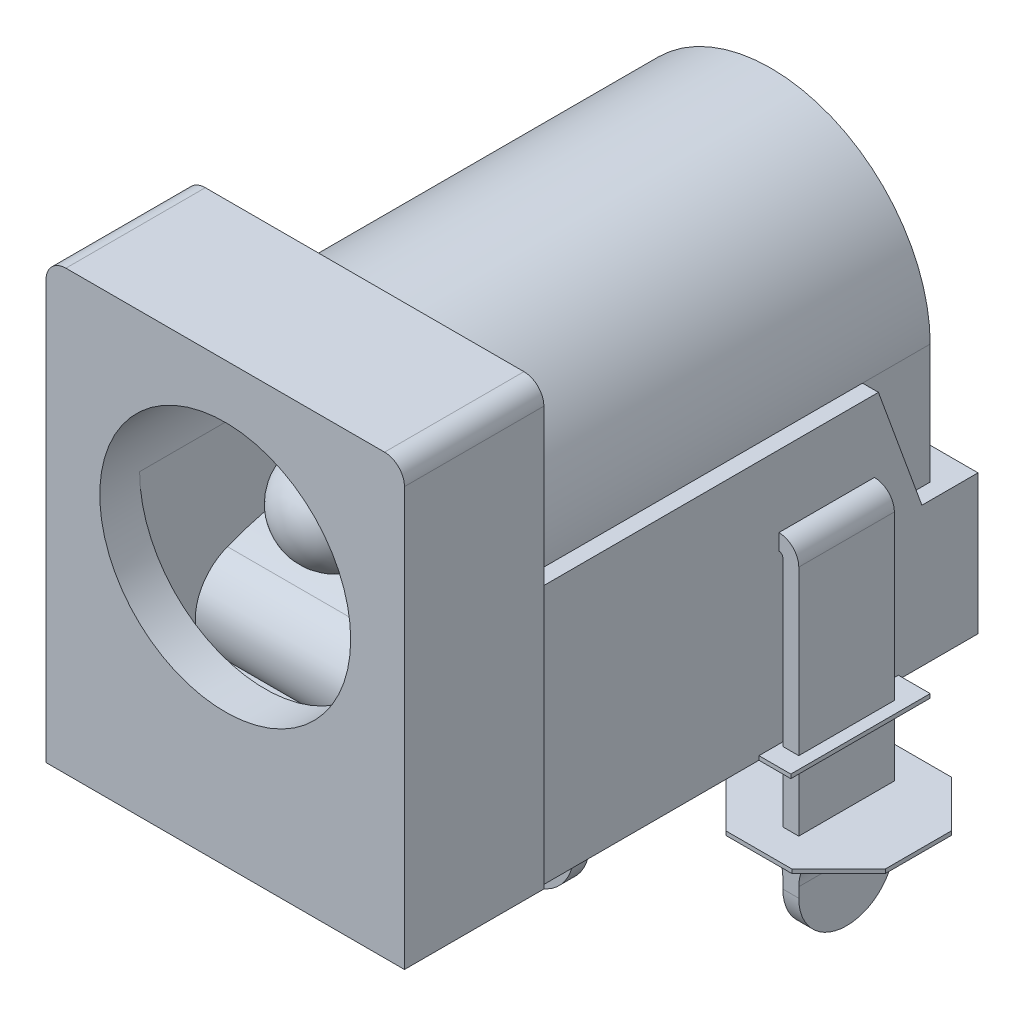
SolidWorks part; units mm, degrees
ref_plane "Front Plane" through (0, 0, 0) normal (0, 0, 1) x (1, 0, 0)
ref_plane "Top Plane" through (0, 0, 0) normal (0, 1, 0) x (1, 0, 0)
ref_plane "Right Plane" through (0, 0, 0) normal (1, 0, 0) x (0, 0, -1)
sketch "Sketch1" plane through (0, 0, 0) normal (0, 0, 1) x (1, 0, 0)
  line L0 (55, 0) -> (-55, 0) construction
  line L1 (-4, 11) -> (4, 11)
  line L2 (-4.5, 10.5) -> (-4.5, 0)
  line L3 (-4.5, 0) -> (4.5, 0)
  line L4 (4.5, 10.5) -> (4.5, 0)
  arc A2 (-4, 11) -> (-4.5, 10.5) centre (-4, 10.5) ccw
  arc A3 (4, 11) -> (4.5, 10.5) centre (4, 10.5) cw
  point P11 (4.5, 0)
  point P14 (-4.5, 11)
  point P17 (4.5, 11)
  dimension "D3" = 0.5
  dimension "D1" = 11
  dimension "D2" = 9
extrude "Boss-Extrude1" add sketch "Sketch1" against normal blind 3.5
sketch "Sketch3" plane through (0, 0, 0) normal (1, 0, 0) x (0, 0, -1)
  line L0 (0, 6.5) -> (12, 6.5)
  line L1 (0, 4.95) -> (0, -4.95) construction
  line L2 (12, 6.5) -> (13.0919, 3.5)
  line L3 (13.0919, 3.5) -> (14.5, 3.5)
  line L4 (14.5, 3.5) -> (14.5, 0)
  line L5 (14.5, 0) -> (0, 0)
  line L6 (0, 0) -> (0, 6.5)
  dimension "D1" = 14.5
  dimension "D2" = 6.5
  dimension "D3" = 3.5
  dimension "D4" = 12
  dimension "D5" = 70
extrude "Boss-Extrude2" add sketch "Sketch3" along normal mid plane 8.8
ref_plane "Plane1" through (0, 0, -13.7) normal (0, 0, 1) x (1, 0, 0)
sketch "Sketch4" plane through (0, 0, -13.7) normal (0, 0, 1) x (1, 0, 0)
  line L0 (0, -6.05) -> (0, 6.05) construction
  line L1 (-4, 6.5) -> (-4, 0)
  line L2 (4.95, 0) -> (-4.95, 0) construction
  line L3 (-4, 0) -> (4, 0)
  line L4 (4, 0) -> (4, 6.5)
  arc A0 (4, 6.5) -> (-4, 6.5) centre (0, 6.5) ccw
  dimension "D1" = 8
  dimension "D2" = 6.5
extrude "Boss-Extrude3" add sketch "Sketch4" along normal blind 12
sketch "Sketch5" plane through (0, 0, 0) normal (0, 0, 1) x (1, 0, 0)
  line L0 (0, -6.05) -> (0, 6.05) construction
  circle A0 centre (0, 6.5) radius 3.15
  arc A1 (4, 6.5) -> (-4, 6.5) centre (0, 6.5) ccw construction
  dimension "D1" = 6.3
extrude "Cut-Extrude1" cut sketch "Sketch5" against normal blind 10
sketch "Sketch6" plane through (0, 0, 0) normal (0, 1, 0) x (1, 0, 0)
  line L0 (4.4, 14.5) -> (-4.4, 14.5) construction
  line L1 (-1.6, 14.5) -> (1.6, 14.5)
  line L2 (-1.6, 14.5) -> (-1.6, 13.7)
  line L3 (-1.6, 13.7) -> (1.6, 13.7)
  line L4 (1.6, 14.5) -> (1.6, 13.7)
  line L5 (-4.95, 13.7) -> (4.95, 13.7) construction
  line L6 (0, -6.05) -> (0, 6.05) construction
  dimension "D1" = 3.2
  dimension "D2" = 1.6
extrude "Cut-Extrude3" cut sketch "Sketch6" along normal blind 10
sketch "Sketch7" plane through (0, 0, -13.7) normal (0, 0, -1) x (-1, 0, 0)
  line L0 (0, 6.05) -> (0, -6.05) construction
  line L3 (-1.5, 5.1771) -> (-1.5, -2.6)
  line L4 (4.95, 0) -> (-4.95, 0) construction
  line L5 (1.5, 5.1771) -> (1.5, -2.6)
  arc A0 (1.5, 5.1771) -> (-1.5, 5.1771) centre (0, 6.5) ccw
  arc A1 (4, 6.5) -> (-4, 6.5) centre (0, 6.5) ccw construction
  arc A2 (-1.5, -2.6) -> (1.5, -2.6) centre (0, -2.6) ccw
  circle A3 centre (0, 6.5) radius 1.25
  dimension "D1" = 4
  dimension "D5" = 2.5
  dimension "D2" = 1.5
  dimension "D3" = 3
  dimension "D4" = 2.6
extrude "Boss-Extrude4" add sketch "Sketch7" along normal blind 0.4 separate body
sketch "Sketch17" plane through (0, 0, -13.7) normal (0, 0, -1) x (-1, 0, 0)
  circle A0 centre (0, 6.5) radius 1.25
  circle A1 centre (0, 6.5) radius 1.25 construction
extrude "Cut-Extrude6" cut sketch "Sketch17" against normal through all
ref_plane "Plane2" through (0, 0, -1) normal (0, 0, 1) x (1, 0, 0)
sketch "Sketch8" plane through (0, 0, -1) normal (0, 0, 1) x (1, 0, 0)
  line L0 (-3.15, 6.5) -> (-3.15, 1.5)
  line L1 (-3.15, 1.5) -> (3.15, 1.5)
  line L2 (3.15, 1.5) -> (3.15, 6.5)
  line L3 (4.95, 0) -> (-4.95, 0) construction
  arc A0 (3.15, 6.5) -> (-3.15, 6.5) centre (0, 6.5) ccw
  circle A1 centre (0, 6.5) radius 3.15 construction
  dimension "D1" = 1.5
extrude "Cut-Extrude4" cut sketch "Sketch8" against normal blind 9
ref_plane "Plane3" through (0, 0, -10.7) normal (0, 0, 1) x (1, 0, 0)
sketch "Sketch9" plane through (0, 0, -10.7) normal (0, 0, 1) x (1, 0, 0)
  line L0 (-3.6, 4.3) -> (4.4, 4.3)
  line L1 (4.5, 0) -> (4.5, 10.5) construction
  line L3 (4.5, 4.2) -> (4.5, -4.2)
  line L4 (4.95, 0) -> (-4.95, 0) construction
  line L5 (0, -7.975) -> (0, 7.975) construction
  arc A0 (4.4, 4.3) -> (4.5, 4.2) centre (4.4, 4.2) cw
  circle A1 centre (0, 6.5) radius 2.75 construction
  circle A2 centre (0, 6.5) radius 3.15 construction
  point P6 (4.5, 4.3)
  dimension "D1" = 0.1
  dimension "D5" = 5.5
  dimension "D2" = 4.2
  dimension "D3" = 4.3
  dimension "D4" = 8
extrude "Extrude-Thin1" add sketch "Sketch9" along normal mid plane 2.4 thin
fillet "Fillet1" radius 1.2 2 edges at (4.7, -4.2, -11.9) (4.7, -4.2, -9.5)
sketch "Sketch11" plane through (0, 0, 0) normal (-1, 0, 0) x (0, 0, 1)
  line L0 (-7.5, -4.1) -> (-7.5, 1.4)
  line L1 (-10, 1.5) -> (-1, 1.5) construction
  line L2 (-7.4, 1.5) -> (-3.5, 1.5)
  line L3 (-8.5, 4.2) -> (-10, 4.2)
  line L4 (-10, 4.3) -> (-10, 1.5) construction
  line L5 (-6.2135, 4.5) -> (-6.2135, 0) construction
  line L6 (-1, -5.17) -> (-1, 5.17) construction
  line L7 (0, -4.95) -> (0, 4.95) construction
  line L10 (4.95, 0) -> (-4.95, 0) construction
  arc A0 (-3.5, 1.5) -> (-3.0545, 3.9179) centre (-3.5, 2.75) ccw
  arc A1 (-3.0545, 3.9179) -> (-8.5, 4.2) centre (-6.2135, -4.3632) ccw
  arc A2 (-7.5, 1.4) -> (-7.4, 1.5) centre (-7.4, 1.4) cw
  point P14 (-5.5, 1.5)
  dimension "D1" = 0.1
  dimension "D4" = 2.5
  dimension "D8" = 1.25
  dimension "D2" = 7.5
  dimension "D3" = 4.5
  dimension "D5" = 4.2
  dimension "D6" = 1.5
  dimension "D7" = 4.1
extrude "Extrude-Thin2" add sketch "Sketch11" along normal mid plane 6 separate body thin
sketch "Sketch12" plane through (0, 0, -7.5) normal (0, 0, 1) x (1, 0, 0)
  line L0 (-1.25, 0) -> (-1.25, -2.85)
  line L1 (4.95, 0) -> (-4.95, 0) construction
  line L2 (1.25, -2.85) -> (1.25, 0)
  line L3 (1.25, 0) -> (3.3, 0)
  line L4 (3.3, 0) -> (3.3, -5)
  line L5 (3.3, -5) -> (-3.3, -5)
  line L6 (-3.3, -5) -> (-3.3, 0)
  line L7 (0, -7.975) -> (0, 7.975) construction
  line L8 (-3.3, 0) -> (-1.25, 0)
  arc A0 (-1.25, -2.85) -> (1.25, -2.85) centre (0, -2.85) ccw
  dimension "D3" = 1.25
  dimension "D1" = 6.6
  dimension "D2" = 3.3
  dimension "D4" = 2.85
  dimension "D5" = 5
extrude "Cut-Extrude5" cut sketch "Sketch12" against normal blind 2
sketch "Sketch16" plane through (0, 0, 0) normal (1, 0, 0) x (0, 0, -1)
  line L1 (2.75, 7.75) -> (14.1, 7.75)
  line L2 (14.1, 5.25) -> (14.1, 7.75) construction
  line L3 (14.1, 7.75) -> (14.1, 8.3)
  line L4 (14.1, 5.1771) -> (14.1, 8.5) construction
  line L5 (14.1, 8.3) -> (14.6, 8.3)
  line L6 (14.6, 8.3) -> (14.6, 7.5)
  line L7 (1.5, 6.5) -> (13.6, 6.5)
  line L8 (0, 5.17) -> (0, -5.17) construction
  line L9 (-2.6287, 6.5) -> (17.8038, 6.5) construction
  line L10 (5.17, 0) -> (-5.17, 0) construction
  arc A0 (2.75, 7.75) -> (1.5, 6.5) centre (2.75, 6.5) ccw
  arc A1 (14.6, 7.5) -> (13.6, 6.5) centre (14.6, 6.5) ccw
  dimension "D1" = 2.5
  dimension "D3" = 1
  dimension "D2" = 6.5
  dimension "D4" = 0.5
  dimension "D5" = 1.5
  dimension "D6" = 3.6
revolve "Revolve1" add sketch "Sketch16" angle 360 about L9
ref_plane "Plane4" through (0, -1.65, 0) normal (0, 1, 0) x (1, 0, 0)
sketch "Sketch19" plane through (0, 0, 0) normal (0, 1, 0) x (1, 0, 0)
  line L0 (4.4, 12) -> (4.4, 3.5) construction
  line L1 (5.2, 12.5) -> (4.4, 12.5)
  line L2 (5.2, 12.5) -> (5.2, 9)
  line L3 (5.2, 9) -> (4.4, 9)
  line L4 (4.4, 12.5) -> (4.4, 9)
  line L5 (-5.17, 0) -> (5.17, 0) construction
  line L6 (0, -8.03) -> (0, 8.03) construction
  line L7 (-1.6, 14.7) -> (1.6, 14.7)
  line L8 (-1.6, 14.7) -> (-1.6, 13.7)
  line L9 (-1.6, 13.7) -> (1.6, 13.7)
  line L10 (1.6, 14.7) -> (1.6, 13.7)
  line L11 (-1.6, 13.7) -> (1.6, 13.7) construction
  dimension "D1" = 3.5
  dimension "D2" = 9
  dimension "D3" = 0.8
  dimension "D4" = 1
  dimension "D5" = 3.2
  dimension "D6" = 1.6
extrude "Boss-Extrude5" add sketch "Sketch19" along normal blind 0.1
sketch "Sketch20" plane through (0, -1.65, 0) normal (0, 1, 0) x (1, 0, 0)
  line L0 (0, -8.085) -> (0, 8.085) construction
  line L1 (-0.8284, 9.7) -> (-2, 8.5284)
  line L2 (-2, 8.5284) -> (-2, 6.8716)
  line L3 (-2, 6.8716) -> (-0.8284, 5.7)
  line L4 (-0.8284, 5.7) -> (0.8284, 5.7)
  line L5 (0.8284, 5.7) -> (2, 6.8716)
  line L6 (2, 6.8716) -> (2, 8.5284)
  line L7 (2, 8.5284) -> (0.8284, 9.7)
  line L8 (0.8284, 9.7) -> (-0.8284, 9.7)
  line L9 (4.9, 10.7) -> (4.5, 10.7) construction
  line L10 (3.8716, 12.7) -> (2.7, 11.5284)
  line L11 (2.7, 11.5284) -> (2.7, 9.8716)
  line L12 (2.7, 9.8716) -> (3.8716, 8.7)
  line L13 (3.8716, 8.7) -> (5.5284, 8.7)
  line L14 (5.5284, 8.7) -> (6.7, 9.8716)
  line L15 (6.7, 9.8716) -> (6.7, 11.5284)
  line L16 (6.7, 11.5284) -> (5.5284, 12.7)
  line L17 (5.5284, 12.7) -> (3.8716, 12.7)
  line L18 (1.25, 7.9) -> (-1.25, 7.9) construction
  line L19 (2, 14.7284) -> (0.8284, 15.9)
  line L20 (0.8284, 15.9) -> (-0.8284, 15.9)
  line L21 (-0.8284, 15.9) -> (-2, 14.7284)
  line L22 (-2, 14.7284) -> (-2, 13.0716)
  line L23 (-2, 13.0716) -> (-0.8284, 11.9)
  line L24 (-0.8284, 11.9) -> (0.8284, 11.9)
  line L25 (0.8284, 11.9) -> (2, 13.0716)
  line L26 (2, 13.0716) -> (2, 14.7284)
  line L27 (-1.5, 13.7) -> (1.5, 13.7) construction
  circle A0 centre (0, 7.7) radius 2 construction
  circle A1 centre (4.7, 10.7) radius 2 construction
  circle A2 centre (0, 13.9) radius 2 construction
  dimension "D1" = 4
  dimension "D2" = 0.2
  dimension "D3" = 0.2
extrude "Boss-Extrude6" add sketch "Sketch20" against normal blind 0.1
fillet "Fillet4" radius 1 6 edges at (0, -1.75, -14.1) (4.5, -1.75, -10.7) (4.9, -1.75, -10.7) (0, -1.75, -7.5) (0, -1.75, -7.9) (0, -1.75, -13.7)
fillet "Fillet5" radius 0.5 6 edges at (1.5, -1.75, -13.9) (4.7, -1.75, -9.5) (-1.25, -1.75, -7.7) (4.7, -1.75, -11.9) (-1.5, -1.75, -13.9) (1.25, -1.75, -7.7)
